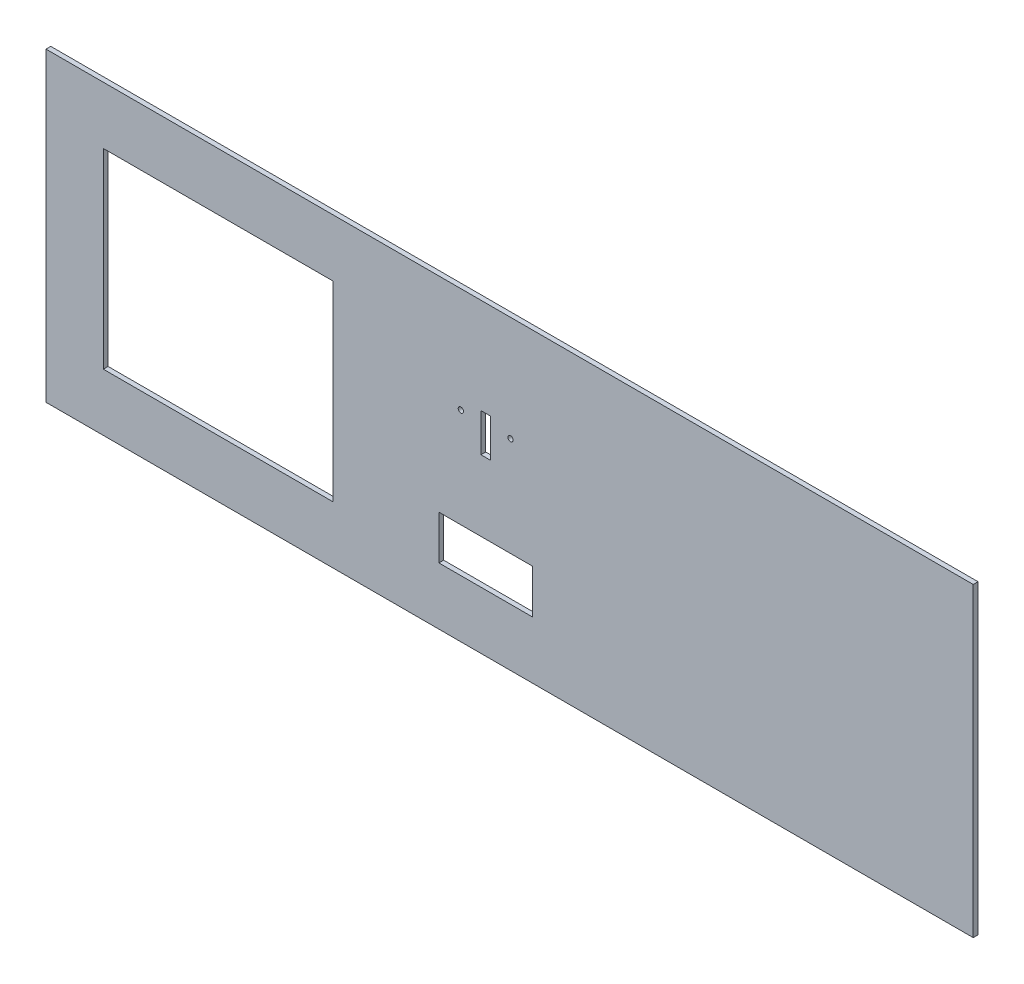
SolidWorks part; units mm, degrees
ref_plane "Front Plane" through (0, 0, 0) normal (0, 0, 1) x (1, 0, 0)
ref_plane "Top Plane" through (0, 0, 0) normal (0, 1, 0) x (1, 0, 0)
ref_plane "Right Plane" through (0, 0, 0) normal (1, 0, 0) x (0, 0, -1)
sketch "Sketch1" plane through (0, 0, 0) normal (0, 0, 1) x (1, 0, 0)
  line L1 (-307.975, -101.6) -> (307.975, -101.6)
  line L2 (-307.975, -101.6) -> (-307.975, 101.6)
  line L3 (-307.975, 101.6) -> (307.975, 101.6)
  line L4 (307.975, -101.6) -> (307.975, 101.6)
  line L5 (-307.975, -101.6) -> (307.975, 101.6) construction
  line L6 (-307.975, 101.6) -> (307.975, -101.6) construction
  point P0 (0, 0)
  dimension "D1" = 203.2
  dimension "D2" = 615.95
extrude "Boss-Extrude1" add sketch "Sketch1" along normal blind 3.175
sketch "Sketch2" plane through (0, 0, 3.175) normal (0, 0, 1) x (1, 0, 0)
  line L0 (307.975, 101.6) -> (-307.975, 101.6) construction
  line L1 (-269.875, -63.5) -> (-117.475, -63.5)
  line L2 (-269.875, -63.5) -> (-269.875, 63.5)
  line L3 (-269.875, 63.5) -> (-117.475, 63.5)
  line L4 (-117.475, -63.5) -> (-117.475, 63.5)
  line L5 (-307.975, 101.6) -> (-307.975, -101.6) construction
  dimension "D1" = 38.1
  dimension "D2" = 38.1
  dimension "D3" = 127
  dimension "D4" = 152.4
extrude "Cut-Extrude1" cut sketch "Sketch2" against normal through all
sketch "Sketch3" plane through (0, 0, 3.175) normal (0, 0, 1) x (1, 0, 0)
  line L0 (-117.475, -63.5) -> (-117.475, 63.5) construction
  line L1 (-19.05, 12.7) -> (-12.7, 12.7)
  line L2 (-19.05, 12.7) -> (-19.05, 38.1)
  line L3 (-19.05, 38.1) -> (-12.7, 38.1)
  line L4 (-12.7, 12.7) -> (-12.7, 38.1)
  line L5 (-19.05, 12.7) -> (-12.7, 38.1) construction
  line L6 (-19.05, 38.1) -> (-12.7, 12.7) construction
  point P0 (-15.875, 25.4)
  dimension "D1" = 25.4
  dimension "D2" = 6.35
  dimension "D3" = 101.6
  dimension "D4" = 25.4
extrude "Cut-Extrude2" cut sketch "Sketch3" against normal through all
sketch "Sketch4" plane through (0, 0, 3.175) normal (0, 0, 1) x (1, 0, 0)
  line L0 (-15.875, 38.1) -> (-15.875, 12.7) construction
  line L1 (-12.7, 38.1) -> (-19.05, 38.1) construction
  line L2 (-19.05, 12.7) -> (-12.7, 12.7) construction
  circle A0 centre (0.635, 31.75) radius 1.75
  circle A1 centre (-32.385, 31.75) radius 1.75
  dimension "D2" = 3.5
  dimension "D1" = 33.02
  dimension "D3" = 6.35
extrude "Cut-Extrude3" cut sketch "Sketch4" against normal through all
sketch "Sketch5" plane through (0, 0, 3.175) normal (0, 0, 1) x (1, 0, 0)
  line L0 (-269.875, -63.5) -> (-117.475, -63.5) construction
  line L1 (-46.99, -63.5) -> (15.24, -63.5)
  line L2 (-46.99, -63.5) -> (-46.99, -34.29)
  line L3 (-46.99, -34.29) -> (15.24, -34.29)
  line L4 (15.24, -63.5) -> (15.24, -34.29)
  line L5 (-46.99, -63.5) -> (15.24, -34.29) construction
  line L6 (-46.99, -34.29) -> (15.24, -63.5) construction
  line L7 (-15.875, 38.1) -> (-15.875, 12.7) construction
  line L8 (-12.7, 38.1) -> (-19.05, 38.1) construction
  line L9 (-19.05, 12.7) -> (-12.7, 12.7) construction
  point P0 (-15.875, -48.895)
  dimension "D1" = 29.21
  dimension "D2" = 62.23
extrude "Cut-Extrude4" cut sketch "Sketch5" against normal through all
